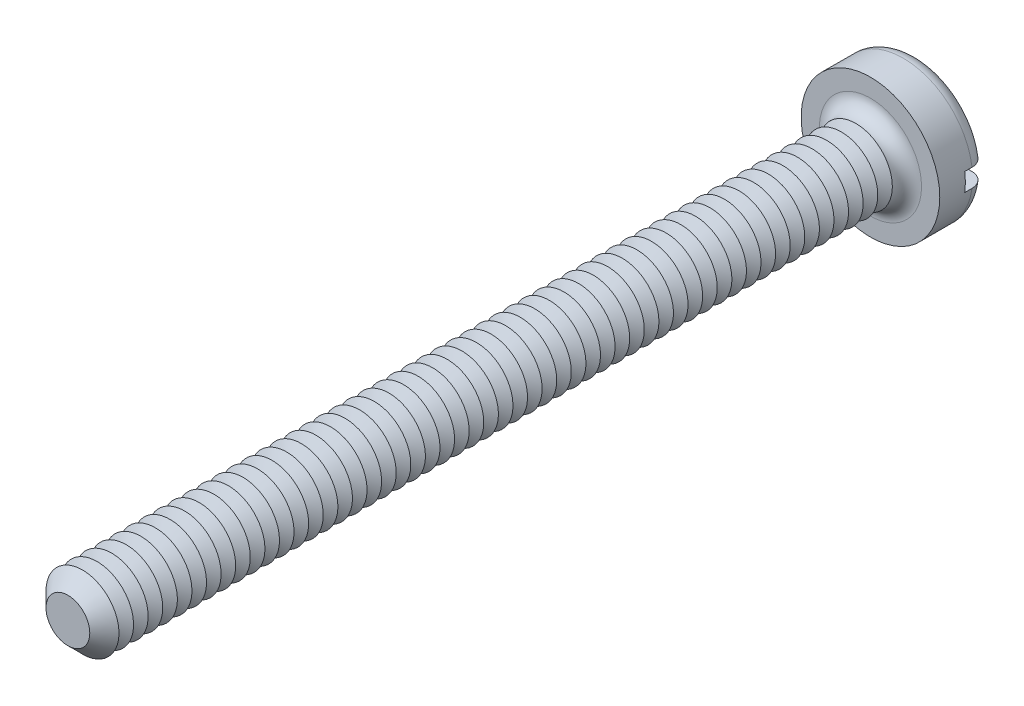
SolidWorks part; units mm, degrees
ref_plane "Front Plane" through (0, 0, 0) normal (0, 0, 1) x (1, 0, 0)
ref_plane "Top Plane" through (0, 0, 0) normal (0, 1, 0) x (1, 0, 0)
ref_plane "Right Plane" through (0, 0, 0) normal (1, 0, 0) x (0, 0, -1)
sketch "Sketch3" plane through (0, 0, 0) normal (0, 0, 1) x (1, 0, 0)
  circle A0 centre (0, 0) radius 1.9
  dimension "D1" = 3.8
extrude "Boss-Extrude2" add sketch "Sketch3" against normal blind 1.3
sketch "Sketch4" plane through (0, 0, 0) normal (0, 0, 1) x (1, 0, 0)
  circle A0 centre (0, 0) radius 1
  dimension "D1" = 2
extrude "Boss-Extrude3" add sketch "Sketch4" along normal blind 22
fillet "Fillet1" radius 0.4 2 edges at (1.9, 0, -1.3) (1, 0, 0)
chamfer "Chamfer1" distance 0.4 angle 45 1 edges at (1, 0, 22)
sketch "Sketch5" plane through (0, 0, 0) normal (1, 0, 0) x (0, 0, -1)
  line L0 (1.6944, 0) -> (-7.6738, 0) construction
sketch "Sketch6" plane through (0, 0, 0) normal (1, 0, 0) x (0, 0, -1)
  line L0 (-0.4, 1) -> (-0.6, 0.6536)
  line L1 (-0.6, 0.6536) -> (-0.8, 1)
  line L2 (-0.4, 1) -> (-21.6, 1) construction
  line L3 (-0.8, 1) -> (-0.4, 1)
  dimension "D1" = 0.4
revolve "Cut-Revolve1" cut sketch "Sketch6" angle 360 about L0
pattern_linear "LPattern1" count 53 spacing 0.4 along (0, 0, 1) of "Cut-Revolve1"
sketch "Sketch8" plane through (0, 0, -1.3) normal (0, 0, -1) x (-1, 0, 0)
  line L1 (1.9, -0.25) -> (-1.9, -0.25)
  line L2 (1.9, -0.25) -> (1.9, 0.25)
  line L3 (1.9, 0.25) -> (-1.9, 0.25)
  line L4 (-1.9, -0.25) -> (-1.9, 0.25)
  line L5 (1.9, -0.25) -> (-1.9, 0.25) construction
  line L6 (1.9, 0.25) -> (-1.9, -0.25) construction
  point P0 (0, 0)
  dimension "D1" = 3.8
  dimension "D2" = 0.5
extrude "Cut-Extrude1" cut sketch "Sketch8" against normal blind 0.6
